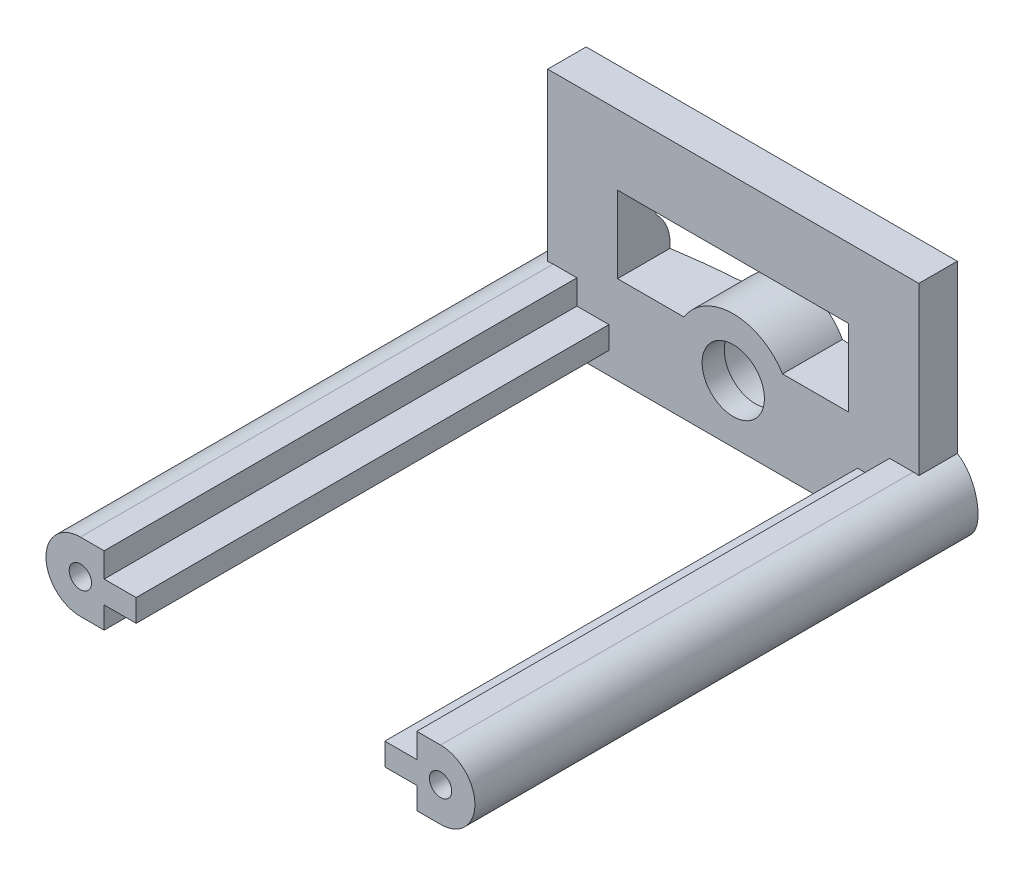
SolidWorks part; units mm, degrees
ref_plane "Front Plane" through (0, 0, 0) normal (0, 0, 1) x (1, 0, 0)
ref_plane "Top Plane" through (0, 0, 0) normal (0, 1, 0) x (1, 0, 0)
ref_plane "Right Plane" through (0, 0, 0) normal (1, 0, 0) x (0, 0, -1)
sketch "Sketch1" plane through (0, 0, 0) normal (0, 0, 1) x (1, 0, 0)
  line L0 (5.8259, 3.5941) -> (13.6017, 3.5941)
  line L1 (-21.9329, 20.9169) -> (21.9329, 20.9169)
  line L2 (-21.9329, 20.9169) -> (-21.9329, -6.8453)
  line L3 (-21.9329, -6.8453) -> (21.9329, -6.8453)
  line L4 (21.9329, 20.9169) -> (21.9329, -6.8453)
  line L5 (-13.6779, 12.6619) -> (13.6017, 12.6619)
  line L6 (-13.6779, 12.6619) -> (-13.6779, 3.5941)
  line L7 (-13.6779, 3.5941) -> (-5.8259, 3.5941)
  line L8 (13.6017, 12.6619) -> (13.6017, 3.5941)
  arc A0 (5.8259, 3.5941) -> (-5.8259, 3.5941) centre (0, 0) ccw
  point P0 (0, 0)
  dimension "D5" = 13.6906
  dimension "D1" = 43.8658
  dimension "D2" = 27.7622
  dimension "D3" = 9.0678
  dimension "D4" = 27.2796
  dimension "D6" = 8.255
  dimension "D7" = 8.255
extrude "Boss-Extrude1" add sketch "Sketch1" along normal blind 7.2644
sketch "Sketch2" plane through (0, 0, 0) normal (0, 0, -1) x (-1, 0, 0)
  line L0 (-17.6657, -6.8453) -> (-4.6454, -5.0277)
  line L1 (-18.1801, -4.8141) -> (-6.0897, -3.1264)
  line L2 (-17.9537, -4.7825) -> (-4.9334, -2.9649) construction
  line L3 (17.6657, -6.8453) -> (4.6454, -5.0277)
  line L4 (18.1801, -4.8141) -> (6.0897, -3.1264)
  line L5 (-21.9329, -2.5781) -> (-21.9329, 20.9169)
  line L6 (-21.9329, 20.9169) -> (21.9329, 20.9169)
  line L7 (21.9329, 20.9169) -> (21.9329, -2.5781)
  line L8 (19.6215, 18.6055) -> (19.6215, -6.8453)
  line L9 (-19.6215, -6.8453) -> (-19.6215, 18.6055)
  line L10 (-19.6215, 18.6055) -> (19.6215, 18.6055)
  line L11 (19.6215, 18.6055) -> (19.6215, -3.2583)
  line L12 (-19.6215, -3.2583) -> (-19.6215, 18.6055)
  line L13 (-19.6215, 18.6055) -> (19.6215, 18.6055)
  line L14 (0, 8.287) -> (0, -10.123) construction
  line L15 (-17.6657, -6.8453) -> (17.6657, -6.8453)
  line L16 (17.6657, -6.8453) -> (17.7698, -6.7389)
  line L22 (15.9893, 1.2827) -> (5.8259, 1.2827)
  line L23 (15.9893, 14.9733) -> (15.9893, 1.2827)
  line L24 (-15.9131, 14.9733) -> (15.9893, 14.9733)
  line L25 (-15.9131, 1.2827) -> (-15.9131, 14.9733)
  line L26 (-5.8259, 1.2827) -> (-15.9131, 1.2827)
  line L27 (15.9893, 1.2827) -> (6.724, 1.2827)
  line L28 (15.9893, 14.9733) -> (15.9893, 1.2827)
  line L29 (-15.9131, 14.9733) -> (15.9893, 14.9733)
  line L30 (-15.9131, 1.2827) -> (-15.9131, 14.9733)
  line L31 (-6.724, 1.2827) -> (-15.9131, 1.2827)
  circle A0 centre (0, 0) radius 6.8453
  circle A1 centre (0, 0) radius 4.4069
  arc A2 (-18.1801, -4.8141) -> (-19.6215, -3.2583) centre (-21.9329, -6.8453) ccw
  circle A3 centre (-21.9329, -6.8453) radius 3.1242
  circle A4 centre (21.9329, -6.8453) radius 3.1242
  arc A5 (18.1801, -4.8141) -> (19.6215, -3.2583) centre (21.9329, -6.8453) cw
  circle A6 centre (-21.9329, -6.8453) radius 4.2672 construction
  arc A7 (-21.9329, -2.5781) -> (-17.6657, -6.8453) centre (-21.9329, -6.8453) ccw
  arc A8 (21.9329, -2.5781) -> (17.6657, -6.8453) centre (21.9329, -6.8453) cw
  dimension "D4" = 8.5344
  dimension "D1" = 2.4384
  dimension "D2" = 2.3114
  dimension "D3" = 2.3114
  dimension "D5" = 2.0828
  dimension "D6" = 1.143
extrude "Cut-Extrude3" cut sketch "Sketch2" against normal blind 4.6482 contours A1 | L4 A5 L11 L13 L12 A2 L1 A0 L31 L30 L29 L28 L27 | A0 L0 L1 | A0 L15 L3
ref_plane "Plane1" through (0, -6.8453, 0) normal (0, -1, 0) x (-1, 0, 0)
sketch "Sketch3" plane through (0, -6.8453, 0) normal (0, -1, 0) x (-1, 0, 0)
  line L0 (-21.9329, -7.2644) -> (-21.9329, 0)
  line L1 (-21.9329, 0) -> (21.9329, 0)
  line L2 (21.9329, 0) -> (21.9329, -7.2644)
  spline S0 degree 2 poles (-21.9329, -7.2644) (0, 7.2644) (21.9329, -7.2644) knots 0 0 0 1 1 1
ref_plane "Plane2" through (0, 20.9169, 0) normal (0, 1, 0) x (1, 0, 0)
sketch "Sketch6" plane through (0, 20.9169, 0) normal (0, 1, 0) x (1, 0, 0)
  line L0 (21.9329, -7.2644) -> (21.9329, 0) construction
  line L1 (-21.9329, -7.2644) -> (21.9329, -7.2644)
  line L2 (-21.9329, -7.2644) -> (-21.9329, -2.7178)
  line L3 (-21.9329, -2.7178) -> (21.9329, -2.7178)
  line L4 (21.9329, -7.2644) -> (21.9329, -2.7178)
  line L6 (-21.9329, -2.7178) -> (21.9329, -2.7178)
  line L7 (-21.9329, -2.7178) -> (-21.9329, 0)
  line L8 (-21.9329, 0) -> (21.9329, 0)
  line L9 (21.9329, -2.7178) -> (21.9329, 0)
  dimension "D1" = 4.5466
extrude "Cut-Extrude12" cut sketch "Sketch6" against normal blind 13.0302 contours L3 L9 L8 L7
sketch "Sketch7" plane through (0, 7.8867, 0) normal (0, 1, 0) x (1, 0, 0)
  line L0 (-21.9329, -2.7178) -> (-21.9329, 0)
  line L1 (-21.9329, 0) -> (21.9329, 0)
  line L2 (21.9329, 0) -> (21.9329, -2.7178)
  line L3 (21.9329, -2.7178) -> (21.9177, -7.0695)
  spline S0 degree 2 poles (-21.9329, -2.7178) (0, 2.7178) (21.9329, -2.7178) knots 0 0 0 1 1 1
extrude "Cut-Extrude16" cut sketch "Sketch7" against normal blind 15.5702 contours L0 S0 L1 M2 | S0 L1 M4 | S0 M2 M4 M1 | L1 S0 L2
fillet "Fillet1" radius 5.08 4 edges
sketch "Sketch8" plane through (0, 0, 4.6482) normal (0, 0, -1) x (-1, 0, 0)
  circle A0 centre (0, 0) radius 3.683
  dimension "D1" = 7.366
extrude "Cut-Extrude17" cut sketch "Sketch8" against normal blind 15.5702
sketch "Sketch10" plane through (0, 0, 7.2644) normal (0, 0, 1) x (1, 0, 0)
  line L0 (-18.4772, -2.7813) -> (-21.2843, -2.7813) construction
  line L1 (-18.4772, -6.8453) -> (-21.2843, -6.8453)
  line L2 (-18.4772, 1.2827) -> (-21.2843, 1.2827)
  line L3 (-21.9329, -6.8453) -> (21.9329, -6.8453) construction
  line L4 (0, 10.3567) -> (0, -11.0974) construction
  line L5 (18.4772, -6.8453) -> (21.2843, -6.8453)
  line L6 (18.4772, -4.2545) -> (18.4772, -6.8453)
  line L7 (14.6926, -1.6129) -> (14.6926, -4.2545)
  line L8 (-18.4772, 1.2827) -> (-18.4772, -1.6129)
  line L9 (-18.4772, -1.6129) -> (-14.6926, -1.6129)
  line L10 (-14.6926, -1.6129) -> (-14.6926, -4.2545)
  line L11 (-14.6926, -4.2545) -> (-18.4772, -4.2545)
  line L12 (-18.4772, -4.2545) -> (-18.4772, -6.8453)
  line L13 (-18.4772, -6.8453) -> (-18.4116, -6.8803)
  line L14 (14.6926, -4.2545) -> (18.4772, -4.2545)
  line L15 (18.4772, -1.6129) -> (14.6926, -1.6129)
  line L16 (18.4772, 1.2827) -> (18.4772, -1.6129)
  line L17 (18.4772, 1.2827) -> (21.2843, 1.2827)
  arc A0 (21.2843, 1.2827) -> (21.2843, -6.8453) centre (21.2843, -2.7813) cw
  arc A1 (-21.2843, 1.2827) -> (-21.2843, -6.8453) centre (-21.2843, -2.7813) ccw
  point P2 (-19.8807, -2.7813)
  dimension "D1" = 4.064
  dimension "D2" = 2.6416
  dimension "D3" = 2.5908
  dimension "D4" = 3.7846
extrude "Boss-Extrude2" add sketch "Sketch10" along normal blind 55.88 contours A0 L17 L16 L15 L7 L14 L6 M2 M5 | A0 M2 | L2 A1 L12 L11 L10 L9 L8 M4 M5 | A1 M4
sketch "Sketch11" plane through (0, 0, 7.2644) normal (0, 0, -1) x (-1, 0, 0)
  line L2 (-21.9329, -6.7932) -> (-21.9329, 1.2306)
  line L3 (-21.9329, -6.7932) -> (-21.9329, 1.2306)
  line L5 (21.9329, 1.2306) -> (21.9329, -6.7932)
  line L6 (21.9329, 1.2306) -> (21.9329, -6.7932)
  arc A2 (-21.9329, 1.2306) -> (-21.9329, -6.7932) centre (-21.2843, -2.7813) ccw
  arc A3 (-21.9329, 1.2306) -> (-21.9329, -6.7932) centre (-21.2843, -2.7813) ccw
  arc A5 (21.9329, -6.7932) -> (21.9329, 1.2306) centre (21.2843, -2.7813) ccw
  arc A6 (21.9329, -6.7932) -> (21.9329, 1.2306) centre (21.2843, -2.7813) ccw
  dimension "D1" = 0
  dimension "D2" = 0
extrude "Boss-Extrude4" add sketch "Sketch11" along normal up to vertex
sketch "Sketch13" plane through (0, -6.8453, 0) normal (0, -1, 0) x (1, 0, 0)
  line L0 (28.4817, 4.7061) -> (28.4817, 0)
  line L1 (28.4817, 0) -> (-28.4817, 0)
  line L2 (0, 0) -> (0, 16.5635) construction
  line L3 (-28.4817, 4.7061) -> (-28.4817, 0)
  spline S0 degree 2 poles (0, 0) (14.7552, -0.0717) (28.4817, 4.7061) knots 0 0 0 1 1 1
  spline S1 degree 2 poles (0, 0) (-14.7552, -0.0717) (-28.4817, 4.7061) knots 0 0 0 1 1 1
extrude "Cut-Extrude20" cut sketch "Sketch13" against normal blind 8.89 contours S0 L1 L0 | L1 S1 L3
sketch "Sketch14" plane through (0, 0, 63.1444) normal (0, 0, 1) x (1, 0, 0)
  circle A0 centre (21.2843, -2.7813) radius 1.3208
  circle A1 centre (-21.2843, -2.7813) radius 1.3208
  dimension "D1" = 2.6416
extrude "Cut-Extrude21" cut sketch "Sketch14" against normal blind 40.64
ref_plane "Plane4" through (0, 0, -1.3718) normal (0, 0, -1) x (-1, 0, 0)
sketch "Sketch15" plane through (0, 0, -1.3718) normal (0, 0, -1) x (-1, 0, 0)
  line L1 (21.9329, 1.2306) -> (21.9329, -6.7932) construction
  circle A0 centre (-21.9329, -3.7263) radius 1.905
  circle A1 centre (21.9329, -3.7263) radius 1.905
  dimension "D1" = 3.81
  dimension "D2" = 3.81
extrude "Cut-Extrude22" cut sketch "Sketch15" against normal blind 36.068
